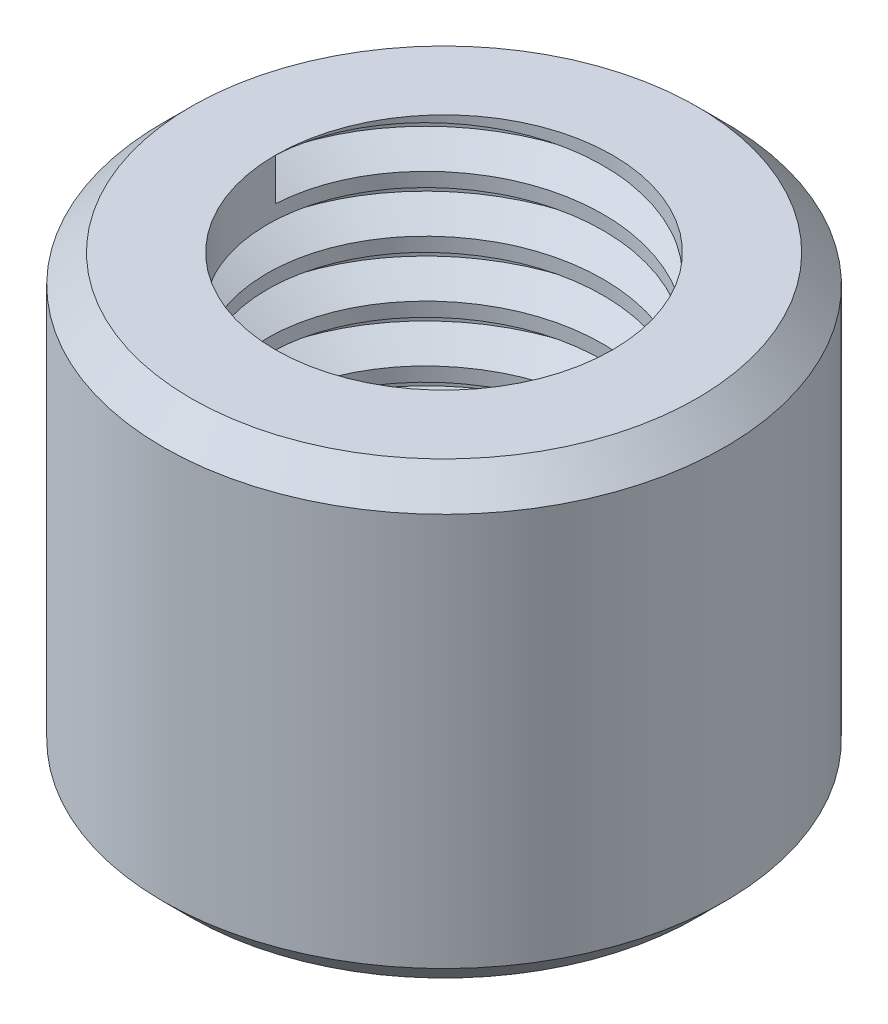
SolidWorks part; units mm, degrees
ref_plane "Front Plane" through (0, 0, 0) normal (0, 0, 1) x (1, 0, 0)
ref_plane "Top Plane" through (0, 0, 0) normal (0, 1, 0) x (1, 0, 0)
ref_plane "Right Plane" through (0, 0, 0) normal (1, 0, 0) x (0, 0, -1)
sketch "Sketch1" plane through (0, 0, 0) normal (0, 1, 0) x (1, 0, 0)
  circle A0 centre (0, 0) radius 2.5
  circle A1 centre (0, 0) radius 1.5
  dimension "D1" = 3
  dimension "D2" = 5
extrude "Boss-Extrude1" add sketch "Sketch1" along normal blind 4
chamfer "Chamfer1" distance 0.25 angle 45 2 edges at (0, 0, 2.5) (0, 4, 2.5)
thread "Thread1" pitch 0.5 start angle 0, offset 0, length 4.5, pitch 0.5, diameter 3
ref_plane "Plane1" through (-1.5, 4, 0) normal (0, 0, 1) x (-1, 0, 0)
sketch "Thread Profile1" plane through (-1.5, 4, 0) normal (0, 0, 1) x (-1, 0, 0)
  line L0 (0, 0) -> (0, 0.5) construction
  line L1 (0, 0) -> (0.2706, 0.1562)
  line L2 (0.2706, 0.1562) -> (0.2706, 0.2187)
  line L3 (0.2706, 0.2187) -> (0, 0.375)
  line L4 (0.2706, 0.1875) -> (0, 0.1875) construction
  line L11 (0, 0) -> (0, 0.375)
  point P2 (0, 0)
  dimension "Pitch" = 0.5
  dimension "Profile_Angle" = 60
  dimension "Profile_Land" = 0.0625
  dimension "Profile_Height" = 0.2706
